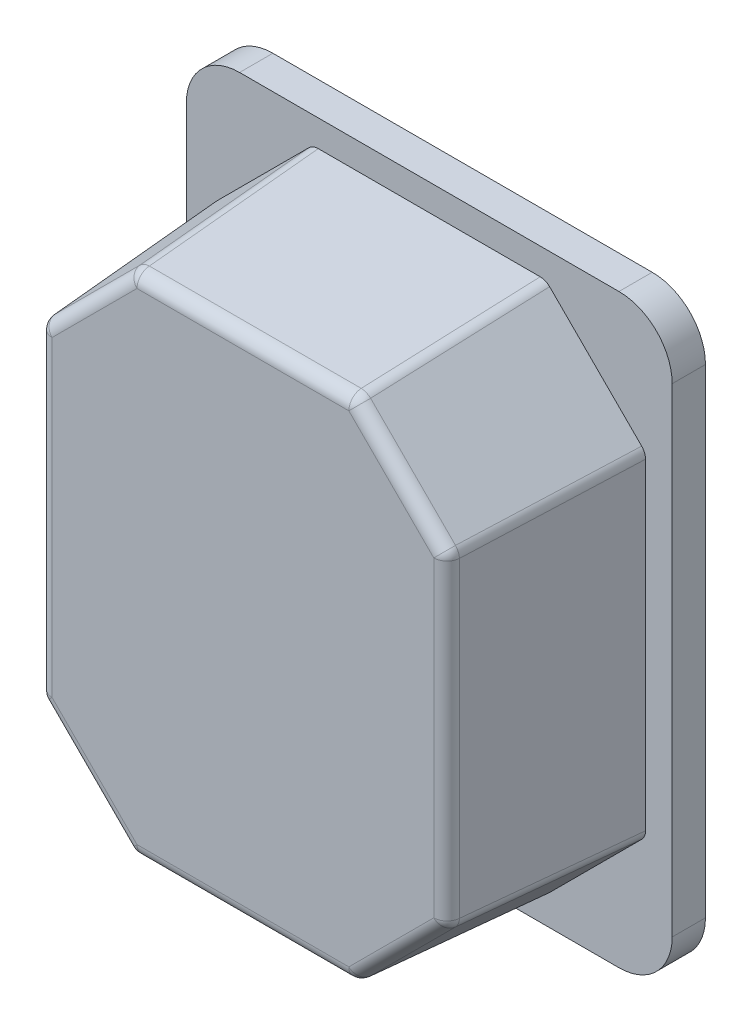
SolidWorks part; units mm, degrees
ref_plane "Face" through (0, 0, 0) normal (0, 0, 1) x (1, 0, 0)
ref_plane "Dessus" through (0, 0, 0) normal (0, 1, 0) x (1, 0, 0)
ref_plane "Droite" through (0, 0, 0) normal (1, 0, 0) x (0, 0, -1)
sketch "Esquisse1" plane through (0, 0, 0) normal (0, 0, 1) x (1, 0, 0)
  line L0 (0, 0) -> (0, 63.3691) construction
  line L1 (-28.5, 44) -> (28.5, 44)
  line L2 (-36.5, 36) -> (-36.5, -36)
  line L3 (-28.5, -44) -> (28.5, -44)
  line L4 (36.5, 36) -> (36.5, -36)
  line L5 (0, 0) -> (68.5127, 0) construction
  arc A0 (-28.5, 44) -> (-36.5, 36) centre (-28.5, 36) ccw
  arc A1 (28.5, 44) -> (36.5, 36) centre (28.5, 36) cw
  arc A2 (28.5, -44) -> (36.5, -36) centre (28.5, -36) ccw
  arc A3 (-36.5, -36) -> (-28.5, -44) centre (-28.5, -36) ccw
  point P10 (-36.5, 44)
  point P13 (36.5, 44)
  point P16 (36.5, -44)
  dimension "D3" = 8
  dimension "D1" = 73
  dimension "D2" = 88
extrude "Base-Extrusion" add sketch "Esquisse1" along normal blind 5
sketch "Esquisse2" plane through (0, 0, 5) normal (0, 0, 1) x (1, 0, 0)
  line L0 (28.5, 44) -> (-28.5, 44) construction
  line L1 (-17.5, 40) -> (17.5, 40)
  line L2 (-32.5, 25) -> (-32.5, -25)
  line L3 (-17.5, -40) -> (17.5, -40)
  line L4 (32.5, 25) -> (32.5, -25)
  line L5 (36.5, -36) -> (36.5, 36) construction
  line L6 (-28.5, -44) -> (28.5, -44) construction
  line L7 (-36.5, 36) -> (-36.5, -36) construction
  line L8 (-32.5, 25) -> (-17.5, 40)
  line L9 (17.5, 40) -> (32.5, 25)
  line L10 (17.5, -40) -> (32.5, -25)
  line L11 (-32.5, -25) -> (-17.5, -40)
  point P0 (-32.5, 40)
  point P1 (32.5, -40)
  point P2 (-32.5, -40)
  point P3 (32.5, 40)
  dimension "D1" = 4
  dimension "D2" = 4
  dimension "D3" = 4
  dimension "D4" = 4
  dimension "D7" = 15
  dimension "D8" = 15
  dimension "D9" = 15
  dimension "D10" = 15
extrude "Boss.-Extru.1" add sketch "Esquisse2" along normal blind 28 draft 4
fillet "Congé-2mm" radius 2
shell "Coque1" thickness 1.5
